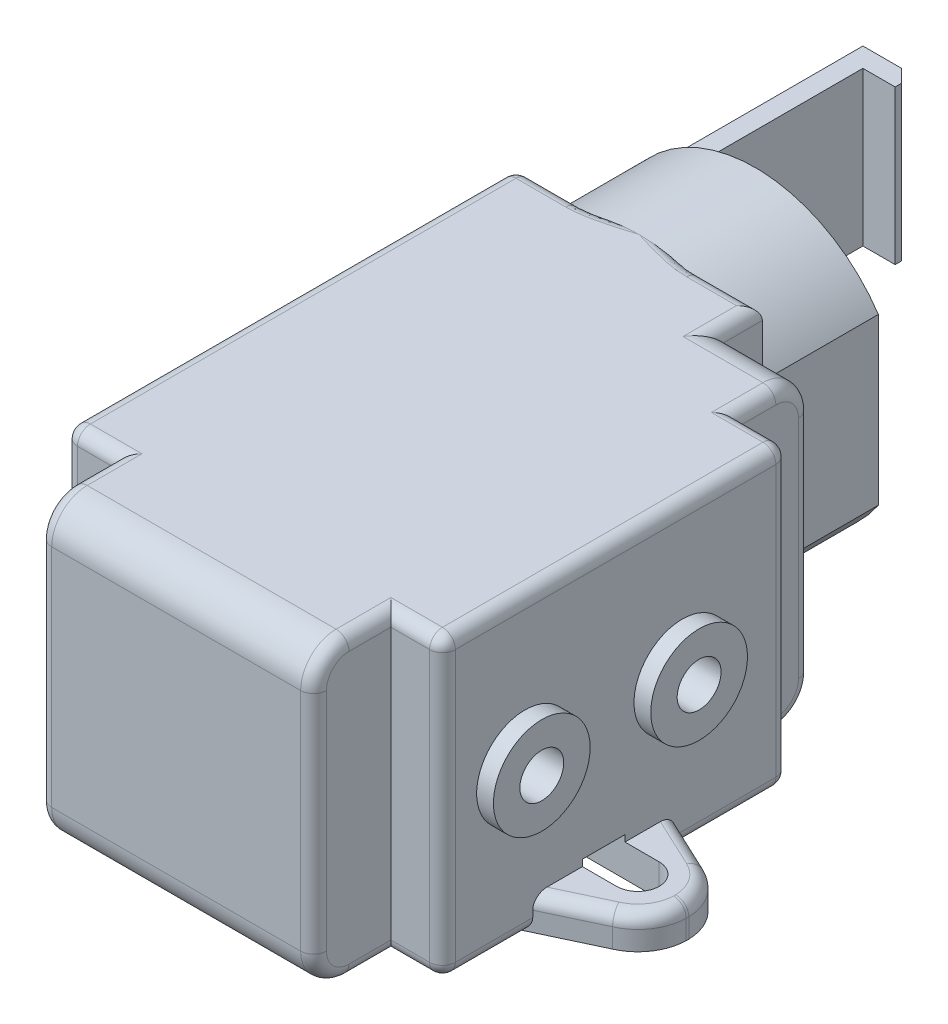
SolidWorks part; units mm, degrees
ref_plane "Plan de face" through (0, 0, 0) normal (0, 0, 1) x (1, 0, 0)
ref_plane "Plan de dessus" through (0, 0, 0) normal (0, 1, 0) x (1, 0, 0)
ref_plane "Plan de droite" through (0, 0, 0) normal (1, 0, 0) x (0, 0, -1)
sketch "Esquisse1" plane through (0, 0, 0) normal (1, 0, 0) x (0, 0, -1)
  line L1 (-25, 11.5) -> (25, 11.5)
  line L2 (-25, 11.5) -> (-25, -11.5)
  line L3 (-25, -11.5) -> (25, -11.5)
  line L4 (25, 11.5) -> (25, -11.5)
  line L5 (-25, 11.5) -> (25, -11.5) construction
  line L6 (-25, -11.5) -> (25, 11.5) construction
  point P0 (0, 0)
extrude "Boss.-Extru.1" add sketch "Esquisse1" along normal blind 29.3
sketch "Esquisse2" plane through (29.3, 0, 0) normal (1, 0, 0) x (0, 0, -1)
  line L0 (-25, 21.0544) -> (-25, -13.4748) construction
  line L1 (13.6, 21.0544) -> (13.6, -13.4748) construction
  line L2 (-6.5, 18.5279) -> (-6.5, -15.4068) construction
  line L3 (-28.1386, 0) -> (7.2328, 0) construction
  line L4 (-19, 16.1004) -> (-19, -14.6166) construction
  line L5 (-25, -11.5) -> (25, -11.5) construction
  line L6 (-12.6, 4.409) -> (-12.6, -15.4068) construction
  line L7 (-25, 11.5) -> (-19, 11.5)
  line L8 (-25, 11.5) -> (-25, -11.5)
  line L9 (-25, -11.5) -> (-19, -11.5)
  line L10 (-19, 11.5) -> (-19, -11.5)
  line L15 (1.3871, -8.5) -> (-11.0474, -8.5) construction
  line L16 (-8.15, -5.8457) -> (-8.15, -12.484) construction
  line L17 (-4.85, -5.8457) -> (-4.85, -12.8803) construction
  line L19 (-8.15, -8.5) -> (-4.85, -8.5)
  line L20 (-8.15, -8.5) -> (-8.15, -11.5)
  line L21 (-8.15, -11.5) -> (-4.85, -11.5)
  line L22 (-4.85, -8.5) -> (-4.85, -11.5)
  circle A0 centre (-12.6, 0) radius 1.7
  circle A1 centre (-0.4, 0) radius 1.7
  dimension "D6" = 1.65
  dimension "D1" = 38.6
  dimension "D2" = 18.5
  dimension "D3" = 6
  dimension "D4" = 6.1
  dimension "D5" = 3
  dimension "D7" = 1.65
extrude "Enlèv. mat.-Extru.1" cut sketch "Esquisse2" against normal blind 4
sketch "Esquisse4" plane through (29.3, 0, 0) normal (1, 0, 0) x (0, 0, -1)
  circle A0 centre (-12.6, 0) radius 1.7
  circle A1 centre (-12.6, 0) radius 3.75
  circle A2 centre (-0.4, 0) radius 3.75
  circle A3 centre (-0.4, 0) radius 1.7
extrude "Boss.-Extru.2" add sketch "Esquisse4" along normal blind 1.3
ref_plane "Plan1" through (14.65, 0, 0) normal (1, 0, 0) x (0, 0, -1)
sketch "Esquisse5" plane through (29.3, 0, 0) normal (1, 0, 0) x (0, 0, -1)
  line L0 (1.3078, -9) -> (-13.7869, -9) construction
  line L1 (-6.5, -16.7296) -> (-6.5, -11.5) construction
  line L2 (-1, -19.8357) -> (-1, -7.7926) construction
  line L3 (-8.15, -11.5) -> (-4.85, -11.5) construction
  line L4 (-12, -7.7926) -> (-12, -19.8357) construction
  line L5 (-4.85, -11.5) -> (25, -11.5) construction
  line L6 (-19, -11.5) -> (-8.15, -11.5) construction
  line L7 (-12, -9) -> (-1, -9)
  line L8 (-12, -9) -> (-12, -11.5)
  line L9 (-12, -11.5) -> (-1, -11.5)
  line L10 (-1, -9) -> (-1, -11.5)
  dimension "D1" = 11
  dimension "D2" = 5.5
  dimension "D3" = 2.5
extrude "Boss.-Extru.3" add sketch "Esquisse5" along normal blind 6.5
sketch "Esquisse6" plane through (0, -11.5, 0) normal (0, -1, 0) x (1, 0, 0)
  line L0 (29.3, 6.5) -> (37.4579, 6.5) construction
  line L2 (35.8, -3.9203) -> (35.8, 6.5) construction
  line L3 (35.8, 12) -> (35.8, 1) construction
  line L4 (33.6, -3.9203) -> (33.6, 8.7576) construction
  line L5 (31.95, 4.85) -> (29.3, 4.85)
  line L6 (29.3, 4.85) -> (29.3, 8.15)
  line L7 (29.3, 8.15) -> (31.95, 8.15)
  line L8 (29.3, 1) -> (33.5875, 3.0142)
  line L9 (29.3, 12) -> (33.5146, 10.0192)
  line L10 (29.3, 12) -> (36.0758, 12)
  line L11 (36.0758, 12) -> (36.0758, 1)
  line L12 (36.0758, 1) -> (29.3, 1)
  arc A0 (31.95, 4.85) -> (31.95, 8.15) centre (31.95, 6.5) ccw
  arc A1 (33.5875, 3.0142) -> (33.5146, 10.0192) centre (31.95, 6.5) ccw
  dimension "D1" = 2.2
extrude "Enlèv. mat.-Extru.2" cut sketch "Esquisse6" against normal blind 2.5
fillet "Congé1" radius 1 4 edges at (31.4438, -9, 2.0071) (35.174, -9, 4.3933) (35.1519, -9, 8.6402) (31.4073, -9, 11.0096)
mirror "Symétrie1" about plane through (14.65, 0, 0) normal (1, 0, 0) of "Congé1", "Enlèv. mat.-Extru.2", "Boss.-Extru.3", "Enlèv. mat.-Extru.1", "Boss.-Extru.2"
sketch "Esquisse7" plane through (29.3, 0, 0) normal (1, 0, 0) x (0, 0, -1)
  line L0 (-19, 14.8423) -> (-19, -13.4235) construction
  line L3 (7.85, 14.8423) -> (7.85, -13.4235) construction
  line L4 (25, 11.5) -> (-19, 11.5) construction
  line L5 (7.85, 11.5) -> (25, 11.5)
  line L6 (7.85, 11.5) -> (7.85, -11.5)
  line L7 (7.85, -11.5) -> (25, -11.5)
  line L8 (25, 11.5) -> (25, -11.5)
  dimension "D1" = 26.85
extrude "Enlèv. mat.-Extru.3" cut sketch "Esquisse7" against normal blind 4
sketch "Esquisse8" plane through (25.3, 0, 0) normal (1, 0, 0) x (0, 0, -1)
  line L0 (-25, -13.8242) -> (-25, 20.6542) construction
  line L1 (13.6, 20.6542) -> (13.6, -13.8242) construction
  line L3 (13.6, 11.5838) -> (25, 11.5838)
  line L4 (13.6, 11.5838) -> (13.6, -11.5)
  line L5 (13.6, -11.5) -> (25, -11.5)
  line L6 (25, 11.5838) -> (25, -11.5)
  dimension "D1" = 38.6
extrude "Enlèv. mat.-Extru.4" cut sketch "Esquisse8" against normal blind 6.2
sketch "Esquisse9" plane through (0, 0, -25) normal (0, 0, -1) x (-1, 0, 0)
  line L0 (12.6704, 0) -> (-23.1193, 0) construction
  line L1 (-9.55, 20.8728) -> (-9.55, -6.8848) construction
  line L2 (-19.1, 6.4068) -> (-19.1, 12.2586)
  line L4 (-19.1, 12.2586) -> (0, 12.2586)
  line L6 (-1.5, 5.9327) -> (-1.5, -5.9327)
  line L7 (-17.6, 5.9327) -> (-17.6, -5.9327)
  line L8 (0, 12.2586) -> (0, 6.4068)
  line L9 (-19.1, -6.4068) -> (-19.1, -12.2586)
  line L10 (-19.1, -12.2586) -> (0, -12.2586)
  line L11 (0, -12.2586) -> (0, -6.4068)
  arc A0 (0, 6.4068) -> (-19.1, 6.4068) centre (-9.55, 0) ccw
  arc A1 (-1.5, 5.9327) -> (-17.6, 5.9327) centre (-9.55, 0) ccw
  arc A3 (-17.6, -5.9327) -> (-1.5, -5.9327) centre (-9.55, 0) ccw
  arc A5 (-19.1, -6.4068) -> (0, -6.4068) centre (-9.55, 0) ccw
extrude "Enlèv. mat.-Extru.5" cut sketch "Esquisse9" against normal blind 9
sketch "Esquisse10" plane through (0, 0, -16) normal (0, 0, -1) x (-1, 0, 0)
  circle A0 centre (-9.4692, 0) radius 3.25
extrude "Enlèv. mat.-Extru.6" cut sketch "Esquisse10" against normal blind 10
sketch "Esquisse11" plane through (0, 0, -25) normal (0, 0, -1) x (-1, 0, 0)
  line L0 (6.2481, 0) -> (-3.5559, 0) construction
  line L1 (10.6128, 6) -> (-3.5559, 6) construction
  line L2 (10.6128, -6) -> (-3.7045, -6) construction
  line L3 (0, -6.4068) -> (0, 6.4068) construction
  line L4 (-1.5, 5.9327) -> (0, 5.9327)
  line L5 (-1.5, 5.9327) -> (-1.5, -6)
  line L6 (-1.5, -6) -> (0, -6)
  line L7 (0, 5.9327) -> (0, -6)
  dimension "D1" = 6
  dimension "D2" = 12
extrude "Boss.-Extru.4" add sketch "Esquisse11" along normal blind 16.4
sketch "Esquisse12" plane through (0, 0, -41.4) normal (0, 0, -1) x (-1, 0, 0)
  line L0 (-1.5, -6) -> (0, -6) construction
  line L1 (0, 5.9327) -> (-4, 5.9327)
  line L2 (0, 5.9327) -> (0, -6)
  line L3 (0, -6) -> (-4, -6)
  line L4 (-4, 5.9327) -> (-4, -6)
extrude "Boss.-Extru.5" add sketch "Esquisse12" along normal blind 1.5
chamfer "Chanfrein1" distance 1 angle 45 1 edges at (4, -0.0336, -42.9)
fillet "Congé2" radius 2.75 4 edges at (22.2, -11.5, -13.6) (22.2, 11.5, -13.6) (14.65, -11.5, 25) (14.65, 11.5, 25)
fillet "Congé3" radius 1 37 edges at (4, -11.5, 20.625) (4, -10.6945, 24.1945) (4, 0, 25) (4, 10.6945, 24.1945) (25.3, -11.5, -9.35) (25.3, -10.6945, -12.7945) (25.3, 0, -13.6) (25.3, 10.6945, -12.7945) (14.325, -11.5, -16) (25.3, 10.6945, 24.1945) (25.3, -11.5, 20.625) (25.3, -10.6945, 24.1945) (27.3, 11.5, -7.85) (29.3, 11.5, 5.575) (27.3, 11.5, 19) (25.3, 11.5, 20.625) (4, 11.5, 20.625) (2, 11.5, 19) (0, 11.5, 1.5) (14.325, 11.5, -16) (4.775, 11.5, -16) (19.1, 11.5, -13.425) (25.3, 11.5, -9.35) (0, 0, 19) (2, -11.5, 19) (0, -11.5, 15.5) (0, -11.5, -7.5) (4.775, -11.5, -16) (0, -8.9534, -16) (0, 8.9534, -16) (27.3, -11.5, -7.85) (29.3, 0, -7.85) (29.3, -11.5, -3.425) (29.3, -11.5, 15.5) (27.3, -11.5, 19) (29.3, 0, 19) (25.3, 0, 25)
sketch "Esquisse13" plane through (0, 0, -25) normal (0, 0, -1) x (-1, 0, 0)
  line L0 (8.9034, 0) -> (0, 0) construction
  line L1 (7.5457, 5.9327) -> (-3, 5.9327) construction
  line L2 (0, 5.9327) -> (-3, 5.9327) construction
  line L3 (-3, 5.9327) -> (-3, -6) construction
  line L4 (7.5457, 6.9327) -> (-3, 6.9327) construction
  line L5 (-2.6794, -5.9327) -> (0.3754, -5.9327)
  line L6 (-2.6794, 6.9327) -> (0.3754, 6.9327)
  line L7 (-2.6794, 6.9327) -> (-2.6794, 5.9327)
  line L8 (-2.6794, 5.9327) -> (0.3754, 5.9327)
  line L9 (0.3754, 6.9327) -> (0.3754, 5.9327)
  line L10 (0.3754, -6.9327) -> (0.3754, -5.9327)
  line L11 (-2.6794, -6.9327) -> (0.3754, -6.9327)
  line L12 (-2.6794, -6.9327) -> (-2.6794, -5.9327)
  dimension "D1" = 1
extrude "Enlèv. mat.-Extru.7" cut sketch "Esquisse13" against normal blind 9
